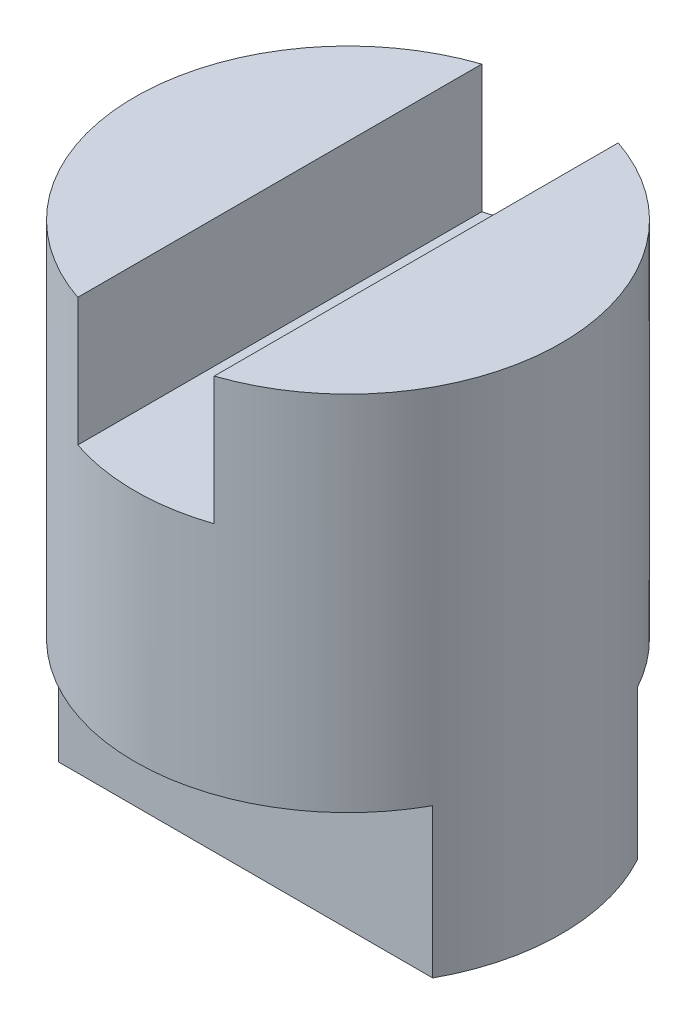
SolidWorks part; units mm, degrees
ref_plane "前视基准面" through (0, 0, 0) normal (0, 0, 1) x (1, 0, 0)
ref_plane "上视基准面" through (0, 0, 0) normal (0, 1, 0) x (1, 0, 0)
ref_plane "右视基准面" through (0, 0, 0) normal (1, 0, 0) x (0, 0, -1)
sketch "草图1" plane through (0, 0, 0) normal (0, 1, 0) x (1, 0, 0)
  circle A0 centre (0, 0) radius 50
  dimension "D1" = 100
extrude "凸台-拉伸1" add sketch "草图1" along normal blind 120
sketch "草图2" plane through (0, 0, 0) normal (0, 0, 1) x (1, 0, 0)
  line L0 (0, 71.8625) -> (0, 124.8025) construction
  line L1 (0, 119.8673) -> (-16, 120)
  line L2 (50, 120) -> (-50, 120) construction
  line L3 (-16, 120) -> (-16, 90)
  line L4 (-16, 90) -> (16, 90)
  line L5 (16, 120) -> (16, 90)
  line L6 (0, 119.8673) -> (16, 120)
  point P10 (0, 90)
  dimension "D1" = 16
  dimension "D2" = 30
extrude "切除-拉伸1" cut sketch "草图2" against normal through all and the other way through all
sketch "草图3" plane through (0, 0, 0) normal (1, 0, 0) x (0, 0, -1)
  line L0 (0, 59.3901) -> (0, -37.7823) construction
  line L1 (-24, 0) -> (-24, 35)
  line L2 (-50, 0) -> (50, 0) construction
  line L3 (-24, 35) -> (-65.0645, 35)
  line L4 (-65.0645, 35) -> (-65.0645, -21.9211)
  line L5 (-65.0645, -21.9211) -> (-24, -21.9211)
  line L6 (-24, -21.9211) -> (-24, 0)
  line L7 (65.0645, -21.9211) -> (24, -21.9211)
  line L8 (65.0645, 35) -> (65.0645, -21.9211)
  line L9 (24, 35) -> (65.0645, 35)
  line L10 (24, 0) -> (24, 35)
  line L11 (24, -21.9211) -> (24, 0)
  dimension "D1" = 35
  dimension "D2" = 24
extrude "切除-拉伸2" cut sketch "草图3" against normal through all and the other way through all
